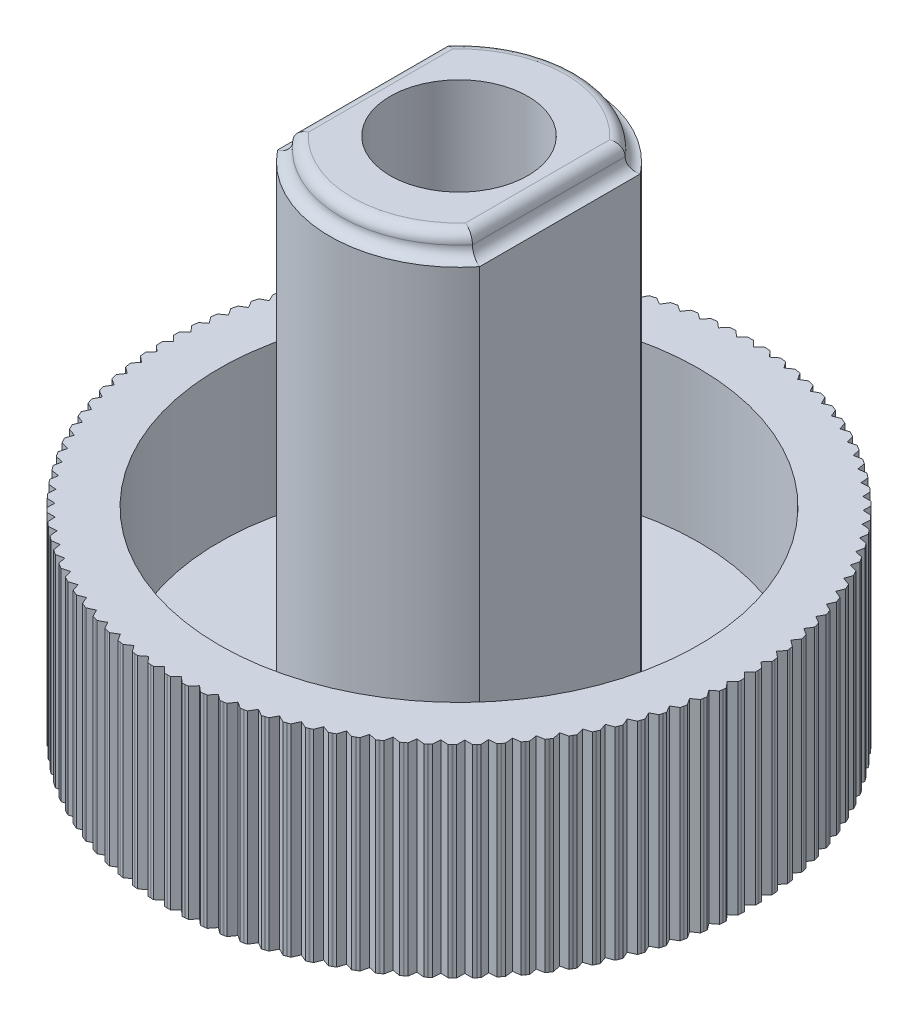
SolidWorks part; units mm, degrees
ref_plane "Płaszczyzna przednia" through (0, 0, 0) normal (0, 0, 1) x (1, 0, 0)
ref_plane "Płaszczyzna górna" through (0, 0, 0) normal (0, 1, 0) x (1, 0, 0)
ref_plane "Płaszczyzna prawa" through (0, 0, 0) normal (1, 0, 0) x (0, 0, -1)
sketch "Szkic1" plane through (0, 0, 0) normal (0, 1, 0) x (1, 0, 0)
  circle A0 centre (0, 0) radius 12.975
  dimension "D1" = 25.95
extrude "Dodanie-wyciągnięcie1" add sketch "Szkic1" along normal blind 9
shell "Skorupa1" thickness 2.3
sketch "Szkic2" plane through (0, 2.3, 0) normal (0, 1, 0) x (1, 0, 0)
  circle A0 centre (0, 0) radius 5.75
extrude "Dodanie-wyciągnięcie2" add sketch "Szkic2" along normal blind 21
sketch "Szkic3" plane through (0, 23.3, 0) normal (0, 1, 0) x (1, 0, 0)
  line L0 (0, 10.675) -> (0, -10.675) construction
  line L1 (-7.8758, 5.4265) -> (-4.5, 5.4265)
  line L2 (-7.8758, 5.4265) -> (-7.8758, -6.1206)
  line L3 (-7.8758, -6.1206) -> (-4.5, -6.1206)
  line L4 (-4.5, 5.4265) -> (-4.5, -6.1206)
  line L5 (4.5, 5.4265) -> (4.5, -6.1206)
  line L6 (7.8758, -6.1206) -> (4.5, -6.1206)
  line L7 (7.8758, 5.4265) -> (7.8758, -6.1206)
  line L8 (7.8758, 5.4265) -> (4.5, 5.4265)
  circle A0 centre (0, 0) radius 10.675 construction
  circle A1 centre (0, 0) radius 10.675 construction
  dimension "D1" = 4.5
extrude "Wytnij-wyciągnięcie1" cut sketch "Szkic3" against normal up to surface (21 mm away)
sketch "Szkic4" plane through (0, 23.3, 0) normal (0, 1, 0) x (1, 0, 0)
  circle A0 centre (0, 0) radius 3.065
extrude "Wytnij-wyciągnięcie2" cut sketch "Szkic4" against normal blind 28.9
sketch "Szkic5" plane through (0, 0, 0) normal (0, -1, 0) x (1, 0, 0)
  line L0 (0, 12.975) -> (0, 0) construction
  line L1 (0, 12.975) -> (0.12, 12.9744)
  line L2 (0.12, 12.9744) -> (0.3707, 12.7229)
  line L3 (0.3707, 12.7229) -> (0.62, 12.9602)
  line L4 (0.62, 12.9602) -> (0.74, 12.9539)
  line L5 (0.74, 12.9539) -> (0.74, 13.2063)
  line L6 (0.74, 13.2063) -> (0, 13.2063)
  line L7 (0, 13.2063) -> (0, 12.975)
  circle A0 centre (0, 0) radius 12.975 construction
  dimension "D1" = 0.12
  dimension "D2" = 0.12
  dimension "D3" = 0.25
  dimension "D4" = 0.5
extrude "Wytnij-wyciągnięcie3" cut sketch "Szkic5" against normal up to surface (9 mm away)
pattern_circular "Szyk kołowy3" count 106 over 360 about axis through (0, 0, 0) along (0, 1, 0) of "Wytnij-wyciągnięcie3"
chamfer "Sfazowanie1" distance 0.1 angle 45 1 edges at (0, 0, 3.065)
sketch "Szkic6" plane through (0, 23.3, 0) normal (0, 1, 0) x (1, 0, 0)
  line L0 (4, -3.4004) -> (4, 3.4004)
  line L1 (-4, 3.4004) -> (-4, -3.4004)
  line L2 (-4.5, 3.5795) -> (-4.5, -3.5795)
  line L3 (4.5, -3.5795) -> (4.5, 3.5795)
  line L4 (-4.5, 3.5795) -> (-4.5, -3.5795)
  line L5 (4.5, -3.5795) -> (4.5, 3.5795)
  arc A0 (-4, -3.4004) -> (4, -3.4004) centre (0, 0) ccw
  arc A1 (4, 3.4004) -> (-4, 3.4004) centre (0, 0) ccw
  arc A2 (-4.5, -3.5795) -> (4.5, -3.5795) centre (0, 0) ccw
  arc A3 (4.5, 3.5795) -> (-4.5, 3.5795) centre (0, 0) ccw
  arc A4 (-4.5, -3.5795) -> (4.5, -3.5795) centre (0, 0) ccw
  arc A5 (4.5, 3.5795) -> (-4.5, 3.5795) centre (0, 0) ccw
  dimension "D1" = 0
  dimension "D2" = 0.5
extrude "Wytnij-wyciągnięcie4" cut sketch "Szkic6" against normal blind 1
fillet "Zaokrąglenie1" radius 0.5 8 edges at (0, 23.3, -5.25) (4, 23.3, 0) (0, 23.3, 5.25) (-4, 23.3, 0) (0, 22.3, -5.25) (-4, 22.3, 0) (0, 22.3, 5.25) (4, 22.3, 0)
